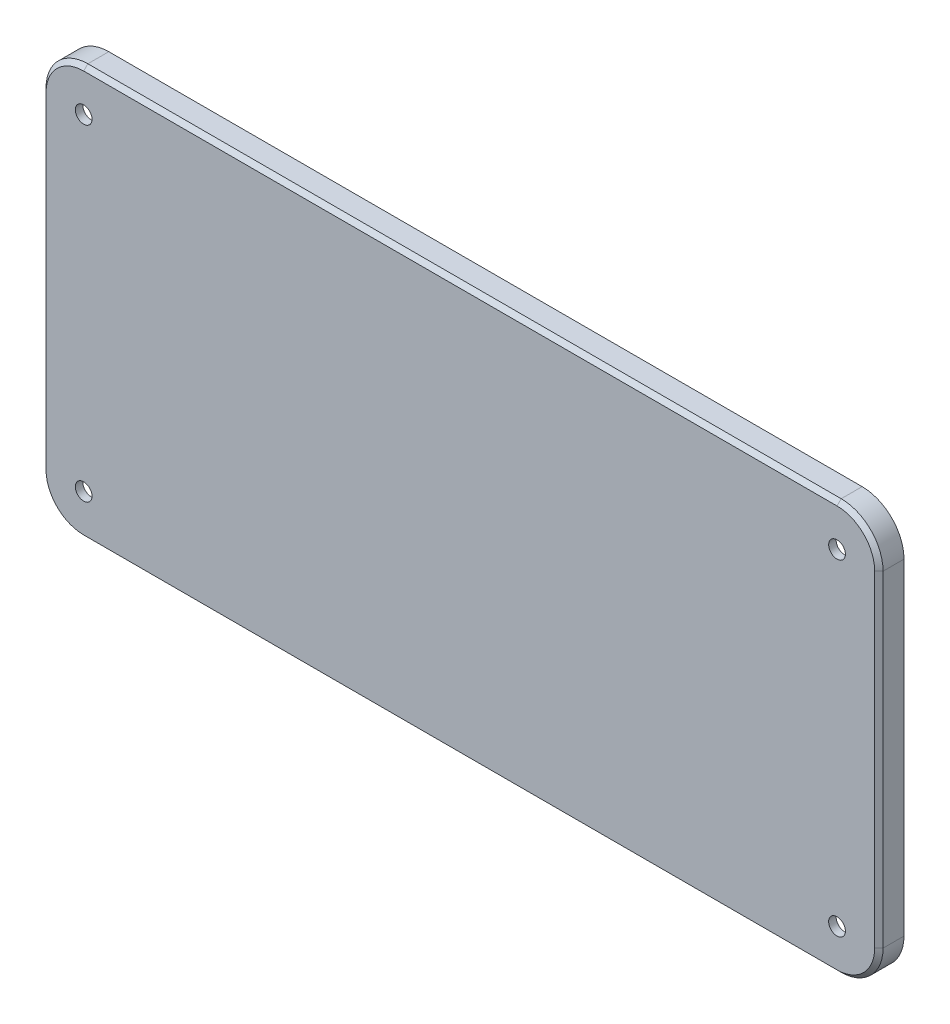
SolidWorks part; units mm, degrees
ref_plane "Plan de face" through (0, 0, 0) normal (0, 0, 1) x (1, 0, 0)
ref_plane "Plan de dessus" through (0, 0, 0) normal (0, 1, 0) x (1, 0, 0)
ref_plane "Plan de droite" through (0, 0, 0) normal (1, 0, 0) x (0, 0, -1)
sketch "Esquisse1" plane through (0, 0, 0) normal (0, 0, 1) x (1, 0, 0)
  line L0 (-90, -39) -> (90, 39) construction
  line L2 (90, -49) -> (-90, -49)
  line L3 (100, -39) -> (100, 39)
  line L4 (90, 49) -> (-90, 49)
  line L5 (-100, -39) -> (-100, 39)
  line L6 (100, -49) -> (-100, 49) construction
  line L7 (100, 49) -> (-100, -49) construction
  circle A0 centre (-90, -39) radius 2
  circle A1 centre (90, -39) radius 2
  circle A2 centre (90, 39) radius 2
  circle A3 centre (-90, 39) radius 2
  arc A4 (-100, -39) -> (-90, -49) centre (-90, -39) ccw
  arc A5 (90, -49) -> (100, -39) centre (90, -39) ccw
  arc A6 (100, 39) -> (90, 49) centre (90, 39) ccw
  arc A7 (-90, 49) -> (-100, 39) centre (-90, 39) ccw
  point P2 (0, 0)
  point P4 (0, 0)
  dimension "D3" = 78
  dimension "D5" = 10
  dimension "D6" = 4
  dimension "D4" = 180
  dimension "D1" = 2
  dimension "D2" = 2
extrude "Boss.-Extru.1" add sketch "Esquisse1" along normal blind 6
shell "Coque1" thickness 1.8
sketch "Esquisse2" plane through (0, 0, 6) normal (0, 0, 1) x (1, 0, 0)
  line L0 (-90, -49) -> (90, -49) construction
  line L1 (53, -49) -> (86, -49)
  line L2 (53, -49) -> (53, -3)
  line L3 (53, -3) -> (86, -3)
  line L4 (86, -49) -> (86, -3)
  line L6 (100, -39) -> (100, 39) construction
  dimension "D1" = 46
  dimension "D2" = 33
  dimension "D3" = 47
chamfer "Chanfrein1" distance 1 angle 45 8 edges at (0, -49, 6) (97.0711, -46.0711, 6) (-97.0711, -46.0711, 6) (100, 0, 6) (-100, 0, 6) (97.0711, 46.0711, 6) (-97.0711, 46.0711, 6) (0, 49, 6)
fillet "Congé1" radius 1.8 8 edges at (95.7983, 44.7983, 4.2) (98.2, 0, 4.2) (95.7983, -44.7983, 4.2) (0, -47.2, 4.2) (-95.7983, -44.7983, 4.2) (-98.2, 0, 4.2) (-95.7983, 44.7983, 4.2) (0, 47.2, 4.2)
